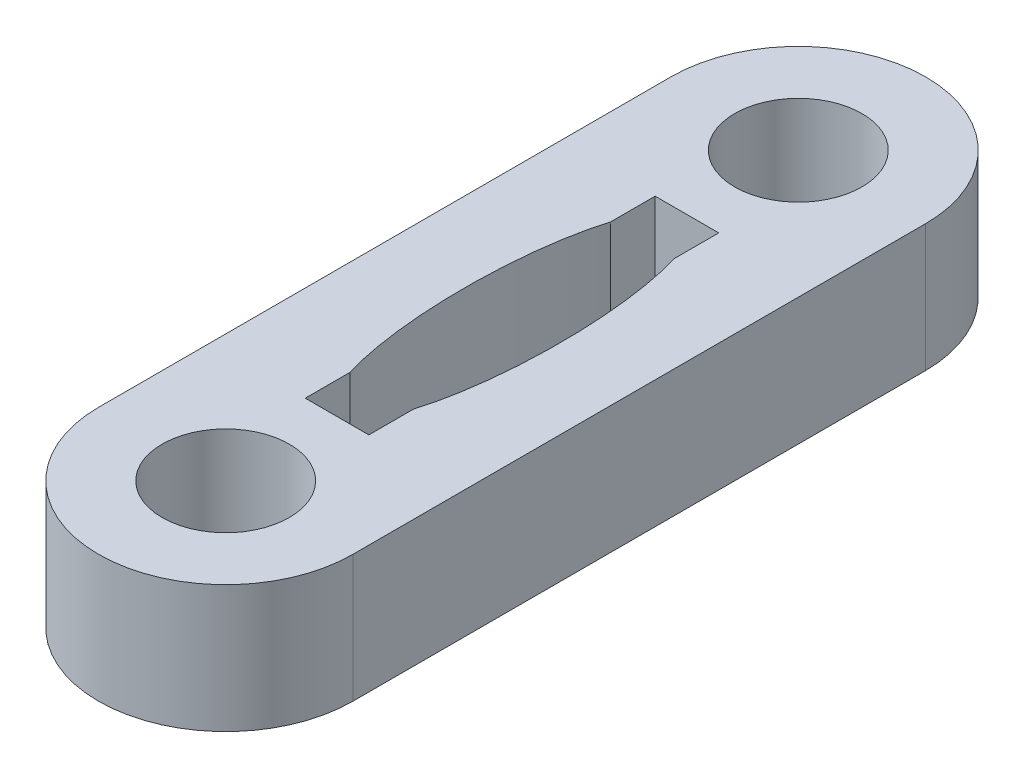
SolidWorks part; units mm, degrees
ref_plane "Front Plane" through (0, 0, 0) normal (0, 0, 1) x (1, 0, 0)
ref_plane "Top Plane" through (0, 0, 0) normal (0, 1, 0) x (1, 0, 0)
ref_plane "Right Plane" through (0, 0, 0) normal (1, 0, 0) x (0, 0, -1)
sketch "Sketch1" plane through (0, 0, 0) normal (0, 1, 0) x (1, 0, 0)
  line L0 (0, 0) -> (0, 45) construction
  line L1 (-5, 27.5) -> (5, 27.5)
  line L2 (0, -45) -> (0, 45) construction
  line L3 (-20, -45) -> (-20, 45)
  line L4 (20, -45) -> (20, 45)
  line L5 (-5, 27.5) -> (-5, 20.4973)
  line L6 (0, 0) -> (25.4492, 0) construction
  line L7 (-5, -27.5) -> (5, -27.5)
  line L8 (-5, -27.5) -> (-5, -20.4973)
  line L9 (5, 27.5) -> (5, 20.4973)
  line L10 (5, -27.5) -> (5, -20.4973)
  arc A0 (-20, -45) -> (20, -45) centre (0, -45) ccw
  arc A1 (20, 45) -> (-20, 45) centre (0, 45) ccw
  circle A2 centre (0, 45) radius 10
  circle A3 centre (0, -45) radius 10
  ellipse E0 centre (0, 0) end of major axis (0, 27.5) minor radius 7.5 (-5, 20.4973) -> (-5, -20.4973) ccw
  ellipse E1 centre (0, 0) end of major axis (0, 27.5) minor radius 7.5 (5, -20.4973) -> (5, 20.4973) ccw
  point P5 (0, 0)
  point P16 (0, 27.5)
  dimension "D3" = 20
  dimension "D1" = 40
  dimension "D2" = 90
  dimension "D4" = 55
  dimension "D5" = 10
  dimension "D6" = 15
extrude "Extrude1" add sketch "Sketch1" along normal mid plane 20
sketch "Sketch6" plane through (0, 10, 0) normal (0, 1, 0) x (1, 0, 0)
  line L7 (-5, -27.5) -> (5, -27.5)
  line L8 (-5, -20.4973) -> (-5, -27.5)
  line L9 (-5, 27.5) -> (-5, 20.4973)
  line L10 (5, 27.5) -> (-5, 27.5)
  line L11 (5, 20.4973) -> (5, 27.5)
  line L12 (5, -27.5) -> (5, -20.4973)
  line L13 (-5, -27.5) -> (5, -27.5)
  line L14 (-5, -20.4973) -> (-5, -27.5)
  line L15 (-5, 27.5) -> (-5, 20.4973)
  line L16 (5, 27.5) -> (-5, 27.5)
  line L17 (5, 20.4973) -> (5, 27.5)
  line L18 (5, -27.5) -> (5, -20.4973)
  ellipse E2 centre (0, 0) end of major axis (0, 27.5) minor radius 7.5 (-5, 20.4973) -> (-5, -20.4973) ccw
  ellipse E3 centre (0, 0) end of major axis (0, 27.5) minor radius 7.5 (5, -20.4973) -> (5, 20.4973) ccw
  ellipse E4 centre (0, 0) end of major axis (0, 27.5) minor radius 7.5 (-5, 20.4973) -> (-5, -20.4973) ccw
  ellipse E5 centre (0, 0) end of major axis (0, 27.5) minor radius 7.5 (5, -20.4973) -> (5, 20.4973) ccw
  dimension "D1" = 0
